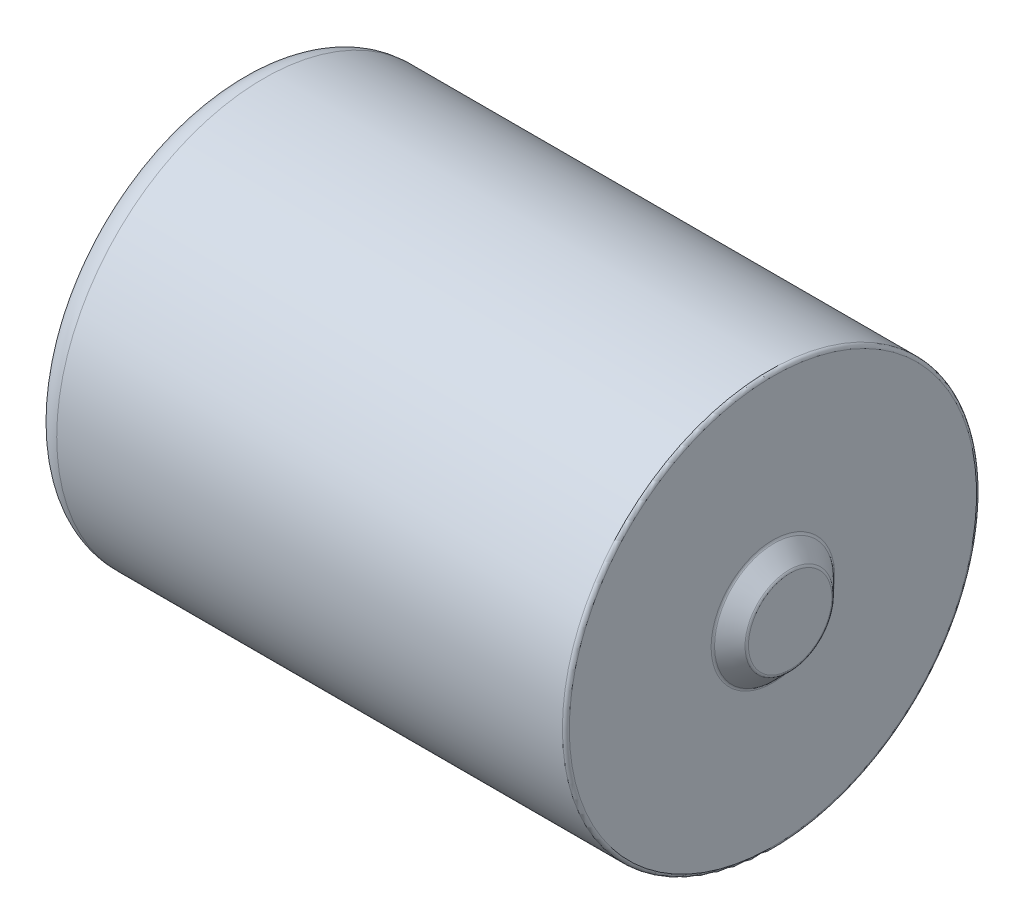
SolidWorks part; units mm, degrees
ref_plane "Face" through (0, 0, 0) normal (0, 0, 1) x (1, 0, 0)
ref_plane "Dessus" through (0, 0, 0) normal (0, 1, 0) x (1, 0, 0)
ref_plane "Droite" through (0, 0, 0) normal (1, 0, 0) x (0, 0, -1)
sketch "Esquisse1" plane through (0, 0, 0) normal (0, 0, 1) x (1, 0, 0)
  line L0 (0, 0) -> (134.1079, 0) construction
  line L1 (3.6268, 1) -> (3.6268, 2.75)
  line L2 (3.6268, 2.75) -> (3.1268, 2.75)
  line L3 (3.1268, 2.75) -> (3.1268, 3.25)
  line L4 (3.1268, 3.25) -> (4.1268, 3.25)
  line L5 (4.1268, 3.25) -> (4.1268, 10.5)
  line L6 (5.6268, 12) -> (35.1268, 12)
  line L7 (35.1268, 12) -> (35.1268, 3.5)
  line L8 (35.1268, 3.5) -> (36.1268, 2.5)
  line L9 (36.1268, 2.5) -> (36.1268, 0)
  line L10 (21.6466, 0) -> (36.1268, 0)
  line L11 (3.6268, 1) -> (21.6466, 1)
  line L12 (21.6466, 1) -> (21.6466, 0)
  arc A0 (4.1268, 10.5) -> (5.6268, 12) centre (5.6268, 10.5) cw
  point P15 (4.1268, 12)
  dimension "D10" = 1.5
  dimension "D1" = 24
  dimension "D2" = 31
  dimension "D3" = 0.5
  dimension "D4" = 0.5
  dimension "D5" = 3.25
  dimension "D6" = 1
  dimension "D7" = 1
  dimension "D8" = 45
  dimension "D9" = 3.5
  dimension "D11" = 2
revolve "Révolution1" add sketch "Esquisse1" angle 360 about L0
fillet "Congé1" radius 0.2
fillet "Congé2" radius 0.2
